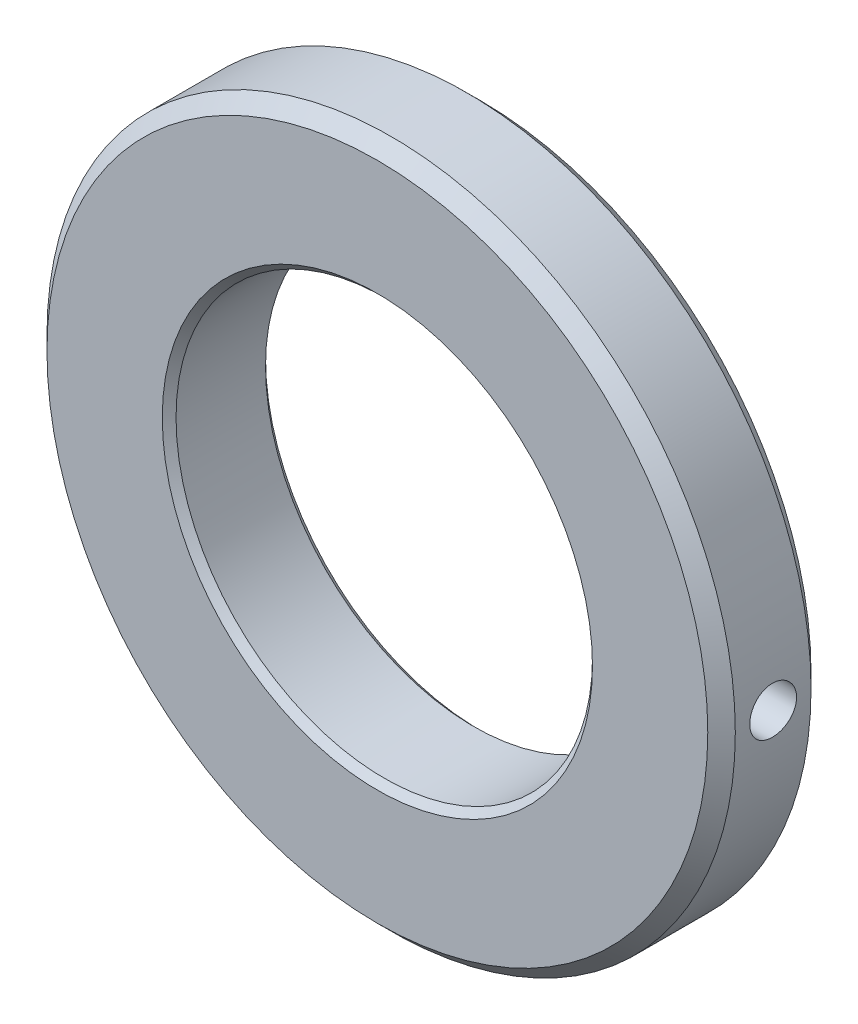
SolidWorks part; units mm, degrees
ref_plane "Plan de face" through (0, 0, 0) normal (0, 0, 1) x (1, 0, 0)
ref_plane "Plan de dessus" through (0, 0, 0) normal (0, 1, 0) x (1, 0, 0)
ref_plane "Plan de droite" through (0, 0, 0) normal (1, 0, 0) x (0, 0, -1)
sketch "Esquisse1" plane through (0, 0, 0) normal (0, 0, 1) x (1, 0, 0)
  circle A0 centre (0, 0) radius 50
  circle A1 centre (0, 0) radius 30.25
  dimension "D1" = 100
  dimension "D2" = 60.5
extrude "Extrusion1" add sketch "Esquisse1" along normal mid plane 15
chamfer "Chanfrein1" distance 1 angle 45 2 edges at (30.25, 0, 7.5) (30.25, 0, -7.5)
chamfer "Chanfrein2" distance 2 angle 45 2 edges at (50, 0, 7.5) (50, 0, -7.5)
hole_wizard "Trou taraudé M8x1.251" positions "Esquisse3D3" profile "Esquisse4" tap size "M8x1.25" standard "ISO"
sketch3d "Esquisse3D3"
  point P0 (50, 0, 0)
sketch "Esquisse4" plane through (50, 0, 0) normal (0, 1, 0) x (0, 0, -1)
  line L0 (0, 0) -> (0, 19.75)
  line L1 (0, 19.75) -> (3.4, 19.75)
  line L2 (3.4, 19.75) -> (3.4, 0)
  line L5 (3.4, 0) -> (0, 0)
  line L11 (0, -6.35) -> (0, 107.95) construction
  dimension "Diamètre du trou pour taraudage jusqu'au prochain" = 6.8
  dimension "Profondeur du trou pour taraudage jusqu'au prochain" = 19.75
